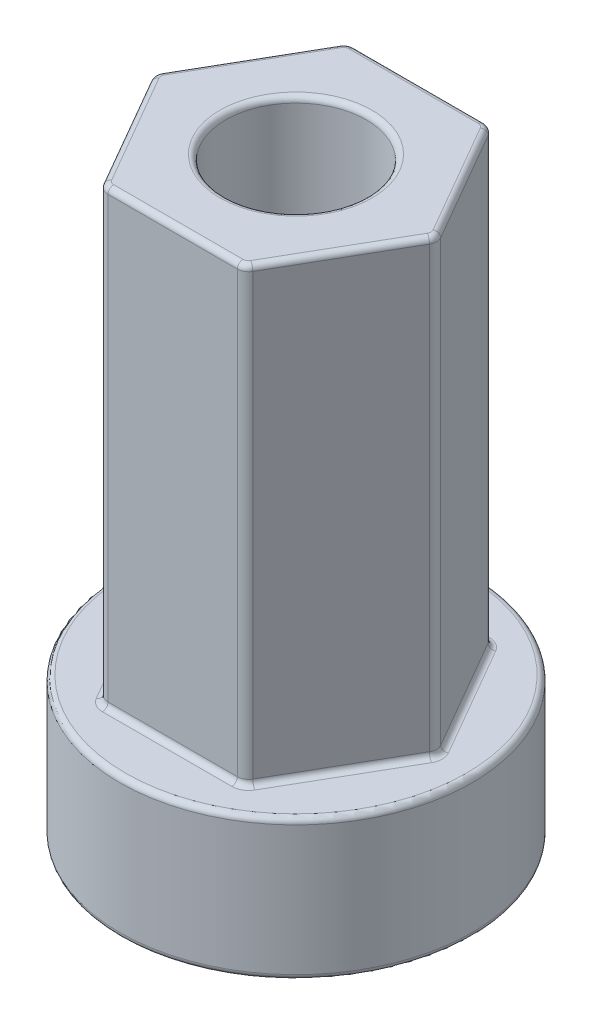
SolidWorks part; units mm, degrees
ref_plane "Front" through (0, 0, 0) normal (0, 0, 1) x (1, 0, 0)
ref_plane "Top" through (0, 0, 0) normal (0, 1, 0) x (1, 0, 0)
ref_plane "Right" through (0, 0, 0) normal (1, 0, 0) x (0, 0, -1)
sketch "Sketch1" plane through (0, 0, 0) normal (0, 1, 0) x (1, 0, 0)
  circle A0 centre (0, 0) radius 7.9375
  dimension "D1" = 15.875
extrude "Extrude1" add sketch "Sketch1" along normal blind 6.35
sketch "Sketch2" plane through (0, 6.35, 0) normal (0, 1, 0) x (-1, 0, 0)
  line L1 (6.4158, 0) -> (3.2079, 5.5563)
  line L2 (3.2079, 5.5563) -> (-3.2079, 5.5563)
  line L3 (-3.2079, 5.5563) -> (-6.4158, 0)
  line L4 (-6.4158, 0) -> (-3.2079, -5.5562)
  line L5 (-3.2079, -5.5562) -> (3.2079, -5.5562)
  line L6 (3.2079, -5.5562) -> (6.4158, 0)
  circle A0 centre (0, 0) radius 5.5562 construction
  dimension "D1" = 11.1125
extrude "Extrude2" add sketch "Sketch2" along normal blind 20.32
sketch "Sketch3" plane through (0, 26.67, 0) normal (0, 1, 0) x (-1, 0, 0)
  circle A0 centre (0, 0) radius 3.175
  dimension "D1" = 6.35
extrude "Cut-Extrude1" cut sketch "Sketch3" against normal through all
fillet "Fillet1" radius 0.508 6 edges at (6.4158, 16.51, 0) (3.2079, 16.51, -5.5562) (-3.2079, 16.51, -5.5562) (-6.4158, 16.51, 0) (-3.2079, 16.51, 5.5563) (3.2079, 16.51, 5.5563)
fillet "Fillet2" radius 0.254 28 edges at (0, 0, 7.9375) (0, 0, 3.175) (0, 26.67, 3.175) (-4.8119, 6.35, -2.7781) (-4.8119, 26.67, -2.7781) (0, 6.35, -5.5562) (0, 26.67, -5.5562) (-4.8119, 26.67, 2.7781) (0, 26.67, 5.5563) (4.8119, 26.67, 2.7781) (4.8119, 26.67, -2.7781) (-6.3372, 26.67, 0) (-3.1686, 26.67, 5.4882) (3.1686, 26.67, 5.4882) (6.3372, 26.67, 0) (3.1686, 26.67, -5.4882) (-3.1686, 26.67, -5.4882) (4.8119, 6.35, -2.7781) (4.8119, 6.35, 2.7781) (0, 6.35, 7.9375) (0, 6.35, 5.5563) (-4.8119, 6.35, 2.7781) (-3.1686, 6.35, -5.4882) (3.1686, 6.35, -5.4882) (6.3372, 6.35, 0) (3.1686, 6.35, 5.4882) (-3.1686, 6.35, 5.4882) (-6.3372, 6.35, 0)
